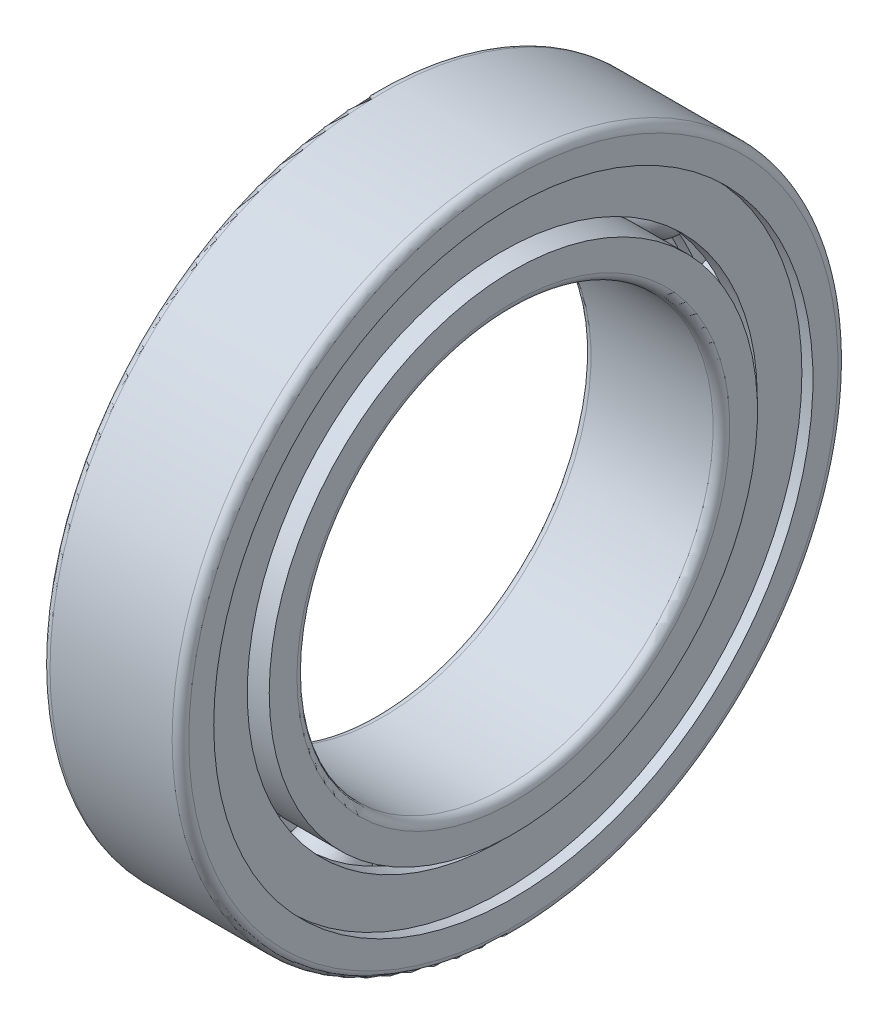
SolidWorks part; units mm, degrees
revolve "凸台-旋转2" add sketch "草图6" angle 360 about L4
sketch "草图6" plane through (0, 0, 0) normal (0, 0, 1) x (1, 0, 0)
  line L0 (0, 0) -> (5.5439, 0) construction
  line L1 (-12.4206, 0) -> (9.8128, 0) construction
  line L2 (0, 0) -> (0, 11.4011) construction
  line L3 (-5.5681, 9.8) -> (6.1049, 9.8) construction
  line L4 (-5.5681, 9.8) -> (6.1049, 9.8) construction
  line L5 (-1.1905, 9.8) -> (1.1905, 9.8)
  arc A0 (-1.1905, 9.8) -> (1.1905, 9.8) centre (0, 9.8) ccw
  dimension "Dw" = 2.381
revolve "基体-旋转" add sketch "草图2" angle 360 about L0
sketch "草图2" plane through (0, 0, 0) normal (0, 0, 1) x (1, 0, 0)
  line L0 (-12.4206, 0) -> (9.8128, 0) construction
  line L1 (0, 0) -> (0, 37.3563) construction
  line L2 (-5.5681, 9.8) -> (6.1049, 9.8) construction
  line L3 (-0.2619, 10.1274) -> (0.2619, 10.1274)
  line L4 (-0.2619, 10.1274) -> (-0.2619, 9.4726)
  line L5 (-0.2619, 9.4726) -> (0.2619, 9.4726)
  line L6 (0.2619, 10.1274) -> (0.2619, 9.4726)
  dimension "D1" = 0.5238
  dimension "D2" = 0.2619
  dimension "D3" = 0.6548
  dimension "D4" = 0.3274
  dimension "D5" = 9.8
revolve "凸台-旋转1" add sketch "草图3" angle 360 about L1
sketch "草图3" plane through (0, 0, 0) normal (0, 0, 1) x (1, 0, 0)
  line L0 (-5.5681, 9.8) -> (6.1049, 9.8) construction
  line L1 (-5.5681, 9.8) -> (6.1049, 9.8) construction
  line L2 (-12.4206, 0) -> (9.8128, 0) construction
  line L3 (-12.4206, 0) -> (9.8128, 0) construction
  line L4 (0, 0) -> (0, 37.3563) construction
  line L5 (0, 0) -> (0, 37.3563) construction
  line L6 (-1.3095, 9.8) -> (1.3096, 9.8)
  arc A0 (-1.3095, 9.8) -> (1.3096, 9.8) centre (0, 9.8) ccw
  dimension "Dwww" = 2.6191
  dimension "D2" = 1.3095
pattern_circular "阵列(圆周)1" count 14 over 360 about axis through (0, 0, 0) along (1, 0, 0) of "凸台-旋转1"
revolve "凸台-旋转3" add sketch "草图7" angle 360 about L0
sketch "草图7" plane through (0, 0, 0) normal (0, 0, 1) x (1, 0, 0)
  line L0 (0, 0) -> (6.6488, 0) construction
  line L1 (0, 0) -> (0, 16.8954) construction
  line L2 (-2.2, 12) -> (2.2, 12)
  line L3 (-2.5, 11.7) -> (-2.5, 10.8)
  line L4 (-2.5, 10.8) -> (-0.6274, 10.8)
  line L5 (2.5, 11.7) -> (2.5, 10.8)
  line L6 (0.6274, 10.8) -> (1.5648, 10.8)
  line L7 (2.1, 10.8) -> (2.5, 10.8)
  line L8 (1.5648, 11.15) -> (2.1, 11.15)
  line L9 (1.5648, 11.15) -> (1.5648, 10.8)
  line L11 (2.1, 11.15) -> (2.1, 10.8)
  arc A0 (-2.2, 12) -> (-2.5, 11.7) centre (-2.2, 11.7) ccw
  arc A1 (2.2, 12) -> (2.5, 11.7) centre (2.2, 11.7) cw
  arc A2 (1.1446, 10.1274) -> (-1.1446, 10.1274) centre (0, 9.8) ccw construction
  arc A3 (0.646, 10.8) -> (-0.0001, 10.9905) centre (0, 9.8) ccw construction
  arc A4 (0.6274, 10.8) -> (-0.6274, 10.8) centre (0, 9.8) ccw
  point P10 (-2.5, 12)
  point P13 (2.5, 12)
ref_plane "基准面1" through (0, 0, 0) normal (0, 0, 1) x (1, 0, 0)
ref_plane "基准面2" through (0, 0, 0) normal (0, 1, 0) x (1, 0, 0)
ref_plane "基准面3" through (0, 0, 0) normal (1, 0, 0) x (0, 0, -1)
sketch "尺寸草图" plane through (0, 0, 0) normal (0, 0, 1) x (1, 0, 0)
  point P0 (0, -75.4307)
  point P1 (2.381, -75.4307)
  point P2 (0, 50.7088)
  point P3 (15, 50.7088)
  point P4 (24, 50.7088)
  point P5 (5, 50.7088)
  point P6 (0, -10.9899)
  point P7 (17.6, -10.9899)
  point P8 (22.3, -10.9899)
  point P9 (0.3, -10.9899)
  point P10 (14, -75.4307)
sketch "草图4" plane through (0, 0, 0) normal (0, 0, 1) x (1, 0, 0)
  line L0 (0, 0) -> (8.1272, 0) construction
  line L1 (-12.4206, 0) -> (9.8128, 0) construction
  line L3 (-0.2619, 10.1274) -> (0.2619, 10.1274) construction
  line L4 (-1.3096, 11.4369) -> (1.3095, 11.4369)
  line L5 (-1.3096, 11.4369) -> (-1.3096, 10.1274)
  line L6 (-1.3096, 10.1274) -> (1.3095, 10.1274)
  line L7 (1.3095, 11.4369) -> (1.3095, 10.1274)
revolve "切除-旋转1" cut sketch "草图4" angle 360 about L0
sketch "草图5" plane through (0, 0, 0) normal (0, 0, 1) x (1, 0, 0)
  line L0 (0, 0) -> (8.2665, 0) construction
  line L1 (-12.4206, 0) -> (9.8128, 0) construction
  line L2 (-0.2619, 9.4726) -> (0.2619, 9.4726) construction
  line L3 (-1.3096, 9.4726) -> (1.3095, 9.4726)
  line L4 (-1.3096, 9.4726) -> (-1.3096, 8.1631)
  line L5 (-1.3096, 8.1631) -> (1.3095, 8.1631)
  line L6 (1.3095, 9.4726) -> (1.3095, 8.1631)
revolve "切除-旋转2" cut sketch "草图5" angle 360 about L0
pattern_circular "阵列(圆周)2" count 14 over 360 about axis through (0, 0, 0) along (1, 0, 0) of "凸台-旋转2"
sketch "草图8" plane through (0, 0, 0) normal (0, 0, 1) x (1, 0, 0)
  line L0 (-12.4206, 0) -> (9.8128, 0) construction
  line L1 (-12.4206, 0) -> (9.8128, 0) construction
  line L2 (2.5, 11.7) -> (2.5, 10.8) construction
  line L3 (-2.5, 8.8) -> (-0.6274, 8.8)
  line L4 (-2.5, 8.8) -> (-2.5, 7.8)
  line L5 (-2.2, 7.5) -> (2.2, 7.5)
  line L6 (2.5, 8.8) -> (2.5, 7.8)
  line L7 (-2.5, 11.7) -> (-2.5, 10.8) construction
  line L8 (0.6274, 8.8) -> (2.5, 8.8)
  arc A0 (-2.5, 7.8) -> (-2.2, 7.5) centre (-2.2, 7.8) ccw
  arc A1 (2.2, 7.5) -> (2.5, 7.8) centre (2.2, 7.8) ccw
  arc A2 (-1.1446, 9.4726) -> (1.1446, 9.4726) centre (0, 9.8) ccw construction
  arc A3 (-1.1446, 9.4726) -> (1.1446, 9.4726) centre (0, 9.8) ccw construction
  arc A4 (-0.6274, 8.8) -> (0.6274, 8.8) centre (0, 9.8) ccw
revolve "凸台-旋转4" add sketch "草图8" angle 360 about L1
sketch "草图10" plane through (0, 0, 0) normal (0, 0, 1) x (1, 0, 0)
  line L0 (1.5648, -10.8) -> (1.5648, 10.8) construction
  line L1 (2.1, 11.15) -> (1.5648, 11.15)
  line L2 (2.1, 11.15) -> (2.1, 9.1929)
  line L3 (2.1, 9.1929) -> (1.5648, 9.1929)
  line L4 (1.5648, 11.15) -> (1.5648, 9.1929)
  line L5 (0.6274, 8.8) -> (2.5, 8.8) construction
  line L6 (0, 0) -> (-5.3515, 0) construction
  line L7 (-12.4206, 0) -> (9.8128, 0) construction
revolve "凸台-旋转5" add sketch "草图10" angle 360 about L6
sketch "草图11" plane through (0, 0, 0) normal (1, 0, 0) x (0, 0, -1)
  circle A0 centre (0, 0) radius 12
  circle A1 centre (0, 0) radius 12 construction
extrude "切除-拉伸1" cut sketch "草图11" against normal blind 10
mirror "镜向所有1" about plane through (0, 0, 0) normal (1, 0, 0)
equation "\"D5@草图7\" = \"防尘圈径D3@尺寸草图\""
equation "\"Z@阵列(圆周)1\"=\"球数Z@尺寸草图\" "
equation "\"Dw@草图6\"=\"球径DW@尺寸草图\""
equation "\"DD@草图8\"=\"d@尺寸草图\""
equation "\"D@草图7\"=\"DD@尺寸草图\""
equation "\"B@草图7\"=\"B@尺寸草图\" "
equation "\"DD2@草图8\"=\"内圈外径DD2@尺寸草图\""
equation "\"R@草图7\"=\"r@尺寸草图\""
equation "\"D3@草图2\" = 0.25*\"Dwww@草图3\""
equation "\"D4@草图2\" = \"D3@草图2\"/2"
equation "\"Dwww@草图3\" = 1.1*\"Dw@草图6\""
equation "\"D2@草图3\" = 0.5*\"Dwww@草图3\""
equation "\"D1@草图2\" = 0.2*\"Dwww@草图3\""
equation "\"D2@草图2\" = 0.5*\"D1@草图2\""
equation "\"切除位置@草图4\" = \"Dwww@草图3\"/2"
equation "\"D1@阵列(圆周)2\" = \"Z@阵列(圆周)1\""
equation "\"D3@草图7\" = \"B@草图7\" / 2"
equation "\"D1@草图8\" = \"R@草图7\""
equation "\"D2@草图7\" = 0.9*\"D@草图7\""
equation "\"D5@草图2\" = 0.25* ( \"D2@草图7\" + \"DD2@草图8\" )  "
equation "\"D6@草图7\" = 0.08 * \"B@草图7\""
equation "\"D1@草图10\" = 0.15*\"Dwww@草图3\""
